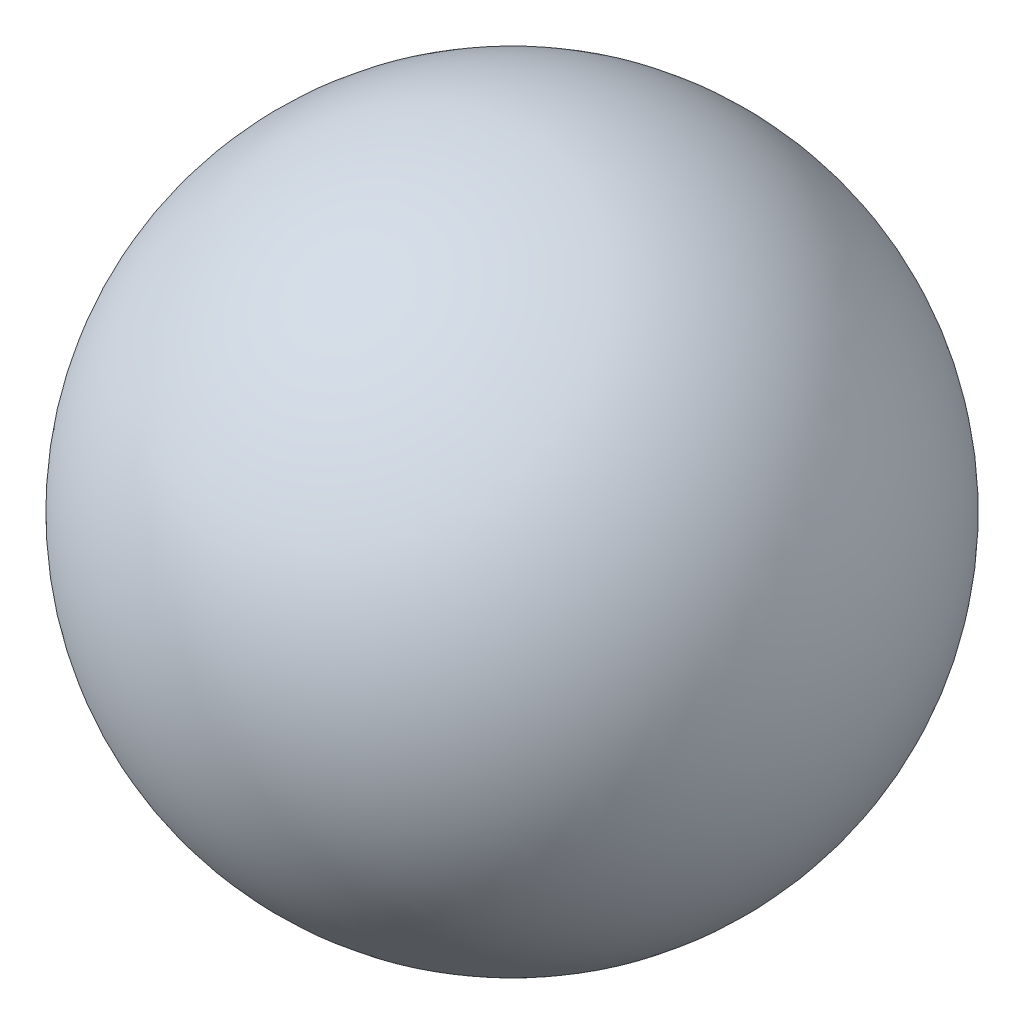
SolidWorks part; units mm, degrees
ref_plane "前视基准面" through (0, 0, 0) normal (0, 0, 1) x (1, 0, 0)
ref_plane "上视基准面" through (0, 0, 0) normal (0, 1, 0) x (1, 0, 0)
ref_plane "右视基准面" through (0, 0, 0) normal (1, 0, 0) x (0, 0, -1)
sketch "草图1" plane through (0, 0, 0) normal (0, 0, 1) x (1, 0, 0)
  line L0 (0, 300) -> (0, -300) construction
  line L1 (0, 299) -> (0, 300)
  line L2 (0, -299) -> (0, -300)
  arc A0 (0, 299) -> (0, -299) centre (0, 0) cw
  arc A1 (0, 300) -> (0, -300) centre (0, 0) cw
  dimension "D0" = 600
  dimension "t" = 1
revolve "旋转1" add sketch "草图1" angle 360 about L0
